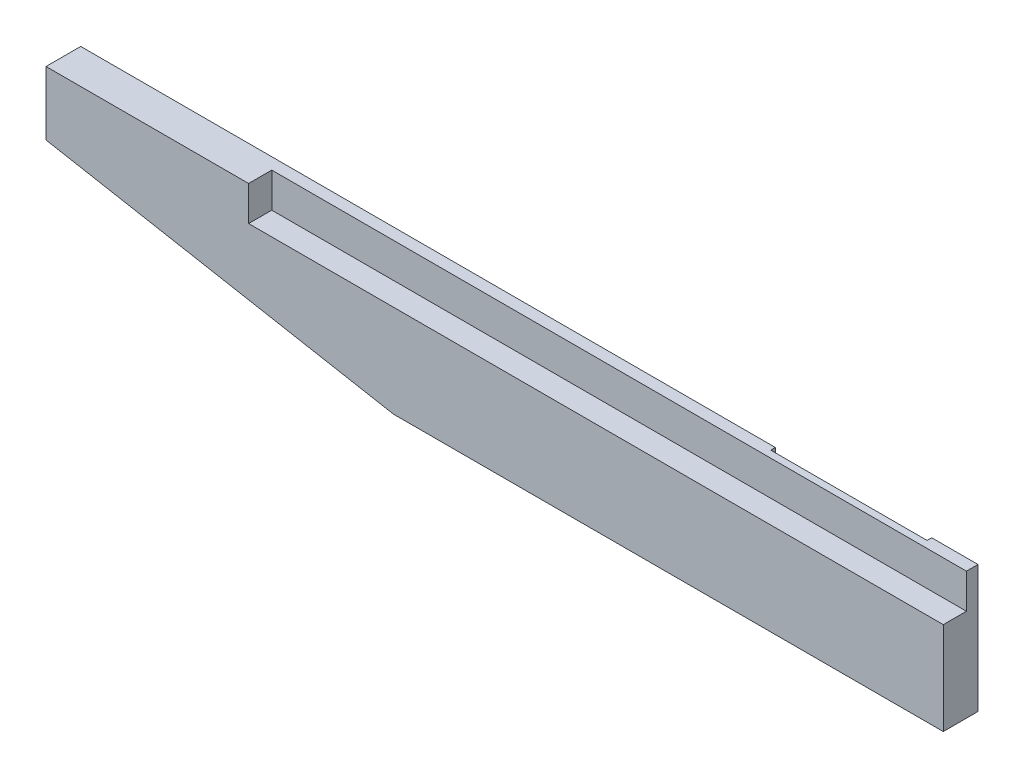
SolidWorks part; units mm, degrees
ref_plane "Front Plane" through (0, 0, 0) normal (0, 0, 1) x (1, 0, 0)
ref_plane "Top Plane" through (0, 0, 0) normal (0, 1, 0) x (1, 0, 0)
ref_plane "Right Plane" through (0, 0, 0) normal (1, 0, 0) x (0, 0, -1)
sketch "Sketch1" plane through (0, 0, 0) normal (0, 1, 0) x (1, 0, 0)
  line L0 (-25.4, 19.05) -> (-111.125, 19.05)
  line L7 (-25.4, 0) -> (-492.125, 0)
  line L9 (-492.125, 0) -> (-492.125, 19.05)
  line L10 (-111.125, 19.05) -> (-492.125, 19.05)
  line L11 (-111.125, 16.51) -> (-111.125, 19.05)
  line L12 (-25.4, 19.05) -> (-25.4, 0)
  line L13 (0, 0) -> (-25.4, 0)
  line L14 (0, 19.05) -> (0, 0)
  line L15 (0, 19.05) -> (-25.4, 19.05)
  line L16 (-25.4, 16.51) -> (-111.125, 16.51)
  dimension "D1" = 2.54
  dimension "D2" = 19.05
  dimension "D3" = 25.4
  dimension "D4" = 466.725
  dimension "D5" = 492.125
extrude "Boss-Extrude1" add sketch "Sketch1" along normal blind 69.85
sketch "Sketch4" plane through (0, 0, -19.05) normal (0, 0, -1) x (-1, 0, 0)
  line L0 (492.125, 34.925) -> (301.625, 0)
  line L1 (492.125, 69.85) -> (492.125, 0) construction
  line L2 (111.125, 0) -> (492.125, 0) construction
extrude "Cut-Extrude3" cut sketch "Sketch4" against normal through all and the other way through all
sketch "Sketch5" plane through (0, 0, 0) normal (1, 0, 0) x (0, 0, -1)
  line L0 (0, 69.85) -> (0, 50.8)
  line L1 (0, 69.85) -> (12.7, 69.85)
  line L2 (12.7, 69.85) -> (12.7, 50.8)
  line L4 (0, 50.8) -> (12.7, 50.8)
extrude "Cut-Extrude4" cut sketch "Sketch5" against normal blind 381
